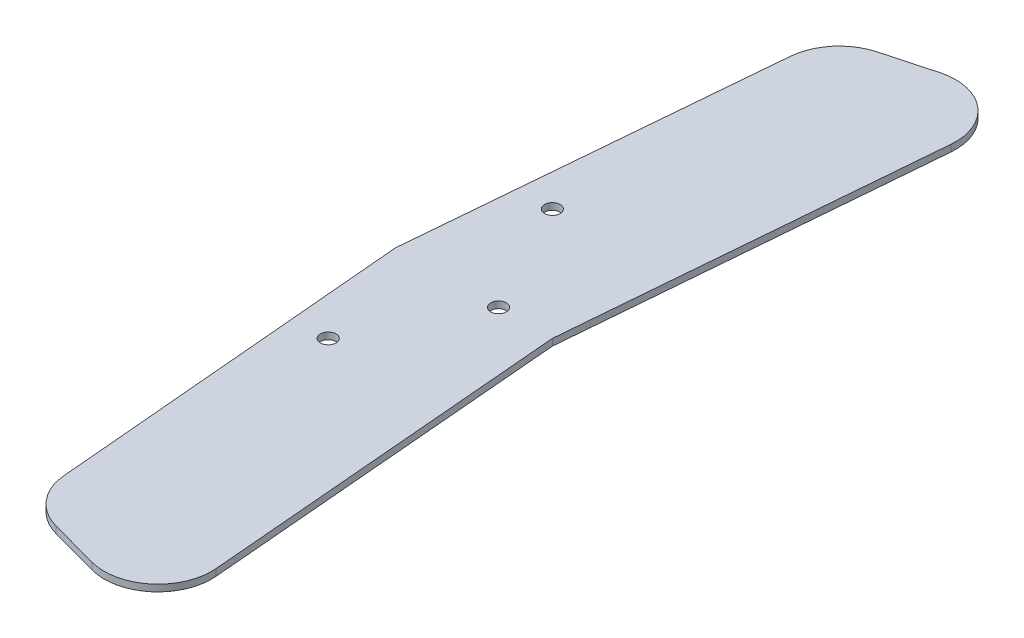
SolidWorks part; units mm, degrees
ref_plane "Front Plane" through (0, 0, 0) normal (0, 0, 1) x (1, 0, 0)
ref_plane "Top Plane" through (0, 0, 0) normal (0, 1, 0) x (1, 0, 0)
ref_plane "Right Plane" through (0, 0, 0) normal (1, 0, 0) x (0, 0, -1)
sketch "Sketch1" plane through (0, 0, 0) normal (0, 1, 0) x (1, 0, 0)
  line L0 (0, 0) -> (35, 0) construction
  line L1 (35, 0) -> (41.957, 81.9854)
  line L2 (0, 0) -> (7.0451, 81.0393)
  line L3 (15.8426, 91.5772) -> (26.8426, 94.5772)
  line L4 (35, 0) -> (41.957, -81.9854)
  line L5 (0, 0) -> (7.0451, -81.0393)
  line L6 (15.8426, -91.5772) -> (26.8426, -94.5772)
  arc A0 (41.957, 81.9854) -> (26.8426, 94.5772) centre (30, 83) ccw
  arc A1 (15.8426, 91.5772) -> (7.0451, 81.0393) centre (19, 80) ccw
  circle A2 centre (23, 0) radius 1.75
  circle A3 centre (10, 25) radius 1.75
  circle A4 centre (10, -25) radius 1.75
  arc A5 (15.8426, -91.5772) -> (7.0451, -81.0393) centre (19, -80) cw
  arc A6 (41.957, -81.9854) -> (26.8426, -94.5772) centre (30, -83) cw
  dimension "D2" = 24
  dimension "D3" = 24
  dimension "D8" = 13
  dimension "D11" = 3.5
  dimension "D12" = 1.75
  dimension "D1" = 35
  dimension "D4" = 80
  dimension "D5" = 83
  dimension "D6" = 11
  dimension "D7" = 19
  dimension "D9" = 12
  dimension "D10" = 25
extrude "Extrude1" add sketch "Sketch1" along normal blind 1.5
